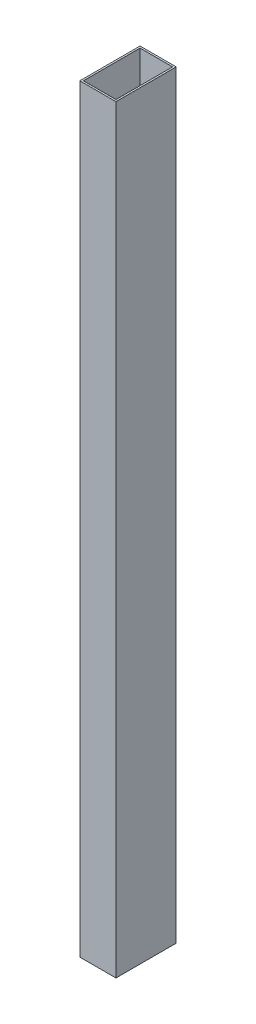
SolidWorks part; units mm, degrees
ref_plane "Front Plane" through (0, 0, 0) normal (0, 0, 1) x (1, 0, 0)
ref_plane "Top Plane" through (0, 0, 0) normal (0, 1, 0) x (1, 0, 0)
ref_plane "Right Plane" through (0, 0, 0) normal (1, 0, 0) x (0, 0, -1)
sketch "Sketch1" plane through (0, 0, 0) normal (0, 1, 0) x (1, 0, 0)
  line L1 (-15, 25) -> (15, 25)
  line L2 (-15, 25) -> (-15, -25)
  line L3 (-15, -25) -> (15, -25)
  line L4 (15, 25) -> (15, -25)
  line L5 (-15, 25) -> (15, -25) construction
  line L6 (-15, -25) -> (15, 25) construction
  point P0 (0, 0)
  dimension "D1" = 50
  dimension "D2" = 30
extrude "Boss-Extrude1" add sketch "Sketch1" along normal blind 630
shell "Shell1" thickness 1.5
